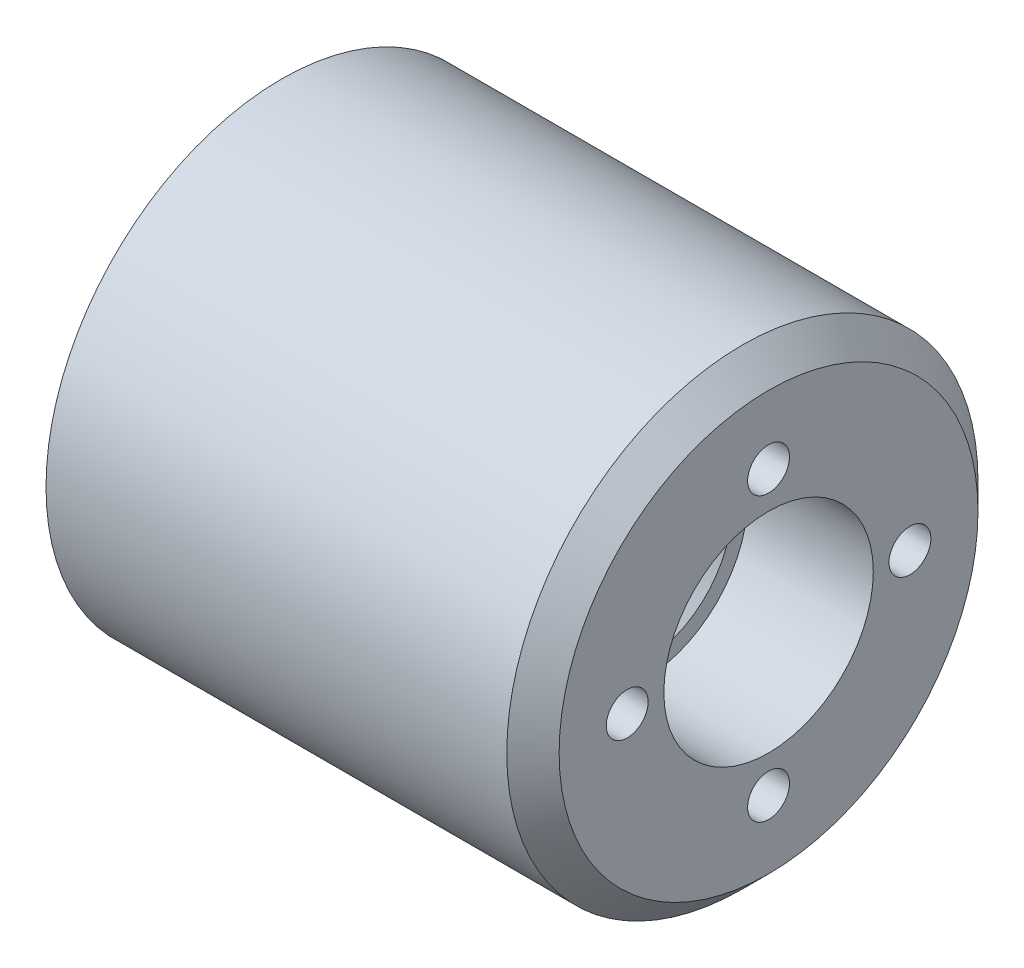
SolidWorks part; units mm, degrees
ref_plane "Face" through (0, 0, 0) normal (0, 0, 1) x (1, 0, 0)
ref_plane "Dessus" through (0, 0, 0) normal (0, 1, 0) x (1, 0, 0)
ref_plane "Droite" through (0, 0, 0) normal (1, 0, 0) x (0, 0, -1)
sketch "Esquisse1" plane through (0, 0, 0) normal (0, 0, 1) x (1, 0, 0)
  line L0 (0, 0) -> (82.2836, 0) construction
  line L1 (0, 31) -> (0, 45)
  line L2 (0, 45) -> (93, 45)
  line L3 (93, 45) -> (93, 20)
  line L4 (93, 20) -> (69, 20)
  line L5 (69, 20) -> (69, 13)
  line L6 (69, 13) -> (61, 13)
  line L7 (61, 13) -> (61, 27)
  line L8 (61, 27) -> (48, 27)
  line L9 (48, 27) -> (48, 31)
  line L10 (48, 31) -> (0, 31)
  dimension "D1" = 26
  dimension "D2" = 54
  dimension "D3" = 62
  dimension "D4" = 90
  dimension "D5" = 40
  dimension "D6" = 24
  dimension "D7" = 48
  dimension "D8" = 61
  dimension "D9" = 93
revolve "Révolution1" add sketch "Esquisse1" angle 360 about L0
chamfer "Chanfrein1" distance 5 angle 45 1 edges at (93, 0, 45)
chamfer "Chanfrein2" distance 4 angle 45 1 edges at (69, 0, 13)
sketch "Esquisse2" plane through (0, 0, 0) normal (-1, 0, 0) x (0, 0, 1)
  line L0 (0, 0) -> (0, 57.3428) construction
  circle A0 centre (0, 37.5) radius 4
  circle A1 centre (0, 0) radius 31 construction
  dimension "D1" = 37.5
  dimension "D2" = 8
extrude "Enlèv. mat.-Extru.1" cut sketch "Esquisse2" against normal blind 15
pattern_circular "Répétition circulaire1" count 6 over 360 about axis through (0, 0, 0) along (1, 0, 0) of "Enlèv. mat.-Extru.1"
sketch "Esquisse3" plane through (93, 0, 0) normal (1, 0, 0) x (0, 0, -1)
  line L0 (0, 0) -> (0, 54) construction
  circle A0 centre (0, 27) radius 4
  circle A1 centre (0, 0) radius 20 construction
  dimension "D1" = 8
  dimension "D2" = 27
extrude "Enlèv. mat.-Extru.2" cut sketch "Esquisse3" against normal blind 15
pattern_circular "Répétition circulaire2" count 4 over 360 about axis through (0, 0, 0) along (1, 0, 0) of "Enlèv. mat.-Extru.2"
